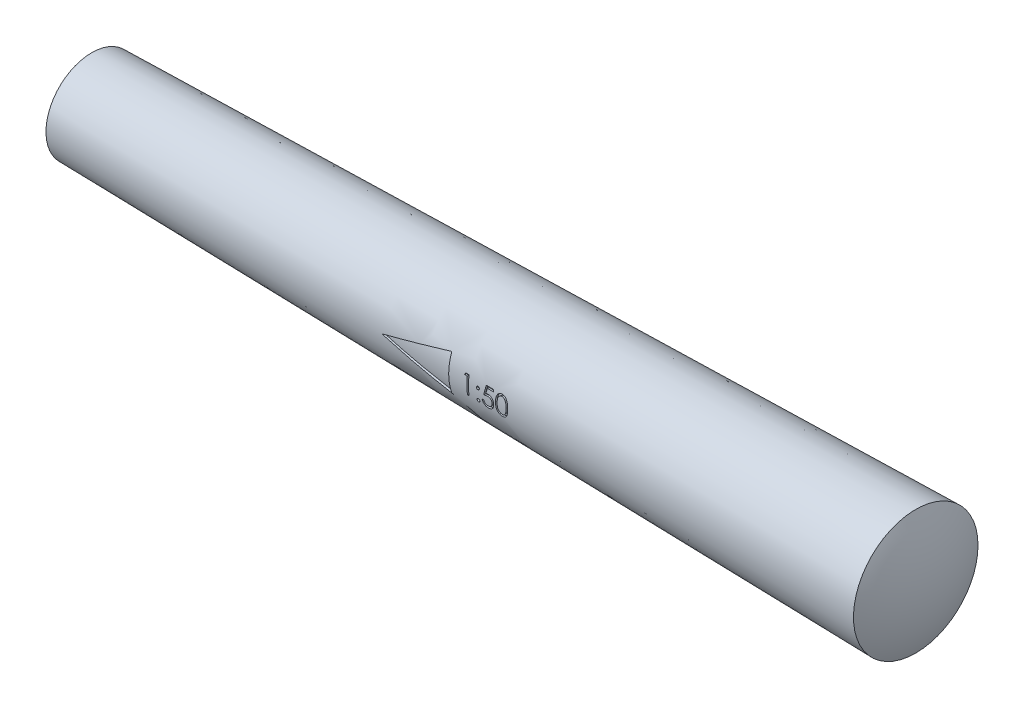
SolidWorks part; units mm, degrees
ref_plane "Front Plane" through (0, 0, 0) normal (0, 0, 1) x (1, 0, 0)
ref_plane "Top Plane" through (0, 0, 0) normal (0, 1, 0) x (1, 0, 0)
ref_plane "Right Plane" through (0, 0, 0) normal (1, 0, 0) x (0, 0, -1)
sketch "Sketch1" plane through (0, 0, 0) normal (1, 0, 0) x (0, 0, -1)
  circle A0 centre (0, 0) radius 2.5
  dimension "D1" = 5
extrude "Extrude1" add sketch "Sketch1" along normal mid plane 45
draft "Draft1" type of draft neutral plane draft angle 1.146 faces to draft 1 parameters "D1"=1.146
sketch "Sketch2" plane through (0, 0, 0) normal (0, 0, 1) x (1, 0, 0)
  line L0 (-22.5, 0) -> (-22.5, 2.5)
  line L1 (-22.5, 2.5) -> (-22.5, -2.5) construction
  line L2 (-22.5, 0) -> (-23.25, 0)
  line L3 (-23.25, 0) -> (-23.25, -2.95) construction
  line L4 (22.5, 0) -> (22.5, 3.4)
  line L5 (22.5, -3.4) -> (22.5, 3.4) construction
  line L6 (22.5, 0) -> (23.25, 0)
  line L7 (23.25, 0) -> (23.25, -2.95) construction
  line L8 (-22.5, -2.5) -> (22.5, -3.4) construction
  arc A0 (-23.25, 0) -> (-22.5, 2.5) centre (-18.7083, 0) cw
  arc A1 (23.25, 0) -> (22.5, 3.4) centre (15.1682, 0) ccw
  point P14 (0, -2.95)
revolve "Revolve1" add sketch "Sketch2" angle 360 about L2
sketch "Sketch5" plane through (0, 0, 0) normal (0, 0, 1) x (1, 0, 0)
  line L0 (0, 2.95) -> (0, -2.95) construction
  line L1 (22.5, 3.4) -> (-22.5, 2.5) construction
  line L2 (-22.5, -2.5) -> (22.5, -3.4) construction
ref_plane "Plane2" through (0, 0, 0) normal (-0.02, 0, 0.9998) x (0.9998, 0, 0.02)
sketch "Sketch6" plane through (0, 0, 0) normal (-0.02, 0, 0.9998) x (0.9998, 0, 0.02)
  line L0 (0, 0) -> (0, 1)
  line L1 (0, 2.95) -> (0, -2.95) construction
  line L2 (0, 1) -> (-3.7321, 0)
  line L3 (-3.7321, 0) -> (0, -1)
  line L4 (0, -1) -> (0, 0)
  line L5 (0, -0.5) -> (4, -0.5) construction
  text T0 "1:50" font "Century Gothic" height 1
  dimension "D1" = 2
  dimension "D2" = 30
  dimension "D3" = 4
wrap "Wrap2" sketch "Sketch6" wrap type deboss source sketch "Sketch6" thickness 0.1 parameters "D1"=0.1
equation "\"D2@Sketch2\" = \"D1@Sketch2\""
